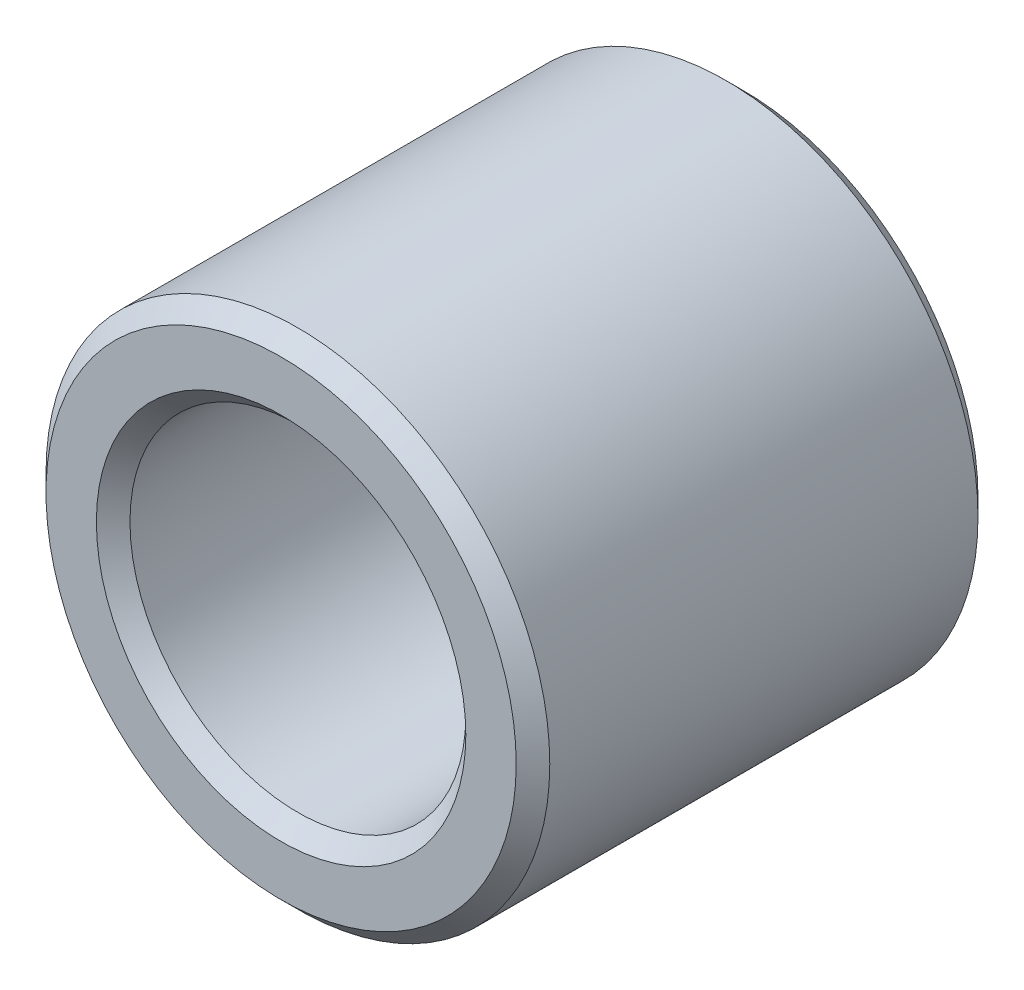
SolidWorks part; units mm, degrees
ref_plane "Front Plane" through (0, 0, 0) normal (0, 0, 1) x (1, 0, 0)
ref_plane "Top Plane" through (0, 0, 0) normal (0, 1, 0) x (1, 0, 0)
ref_plane "Right Plane" through (0, 0, 0) normal (1, 0, 0) x (0, 0, -1)
sketch "Sketch1" plane through (0, 0, 0) normal (0, 0, 1) x (1, 0, 0)
  circle A0 centre (0, 0) radius 40
  circle A1 centre (0, 0) radius 60
  dimension "D1" = 80
  dimension "D2" = 120
extrude "Boss-Extrude1" add sketch "Sketch1" along normal mid plane 110
chamfer "Chamfer1" distance 4 angle 45 4 edges at (40, 0, -55) (60, 0, -55) (40, 0, 55) (60, 0, 55)
